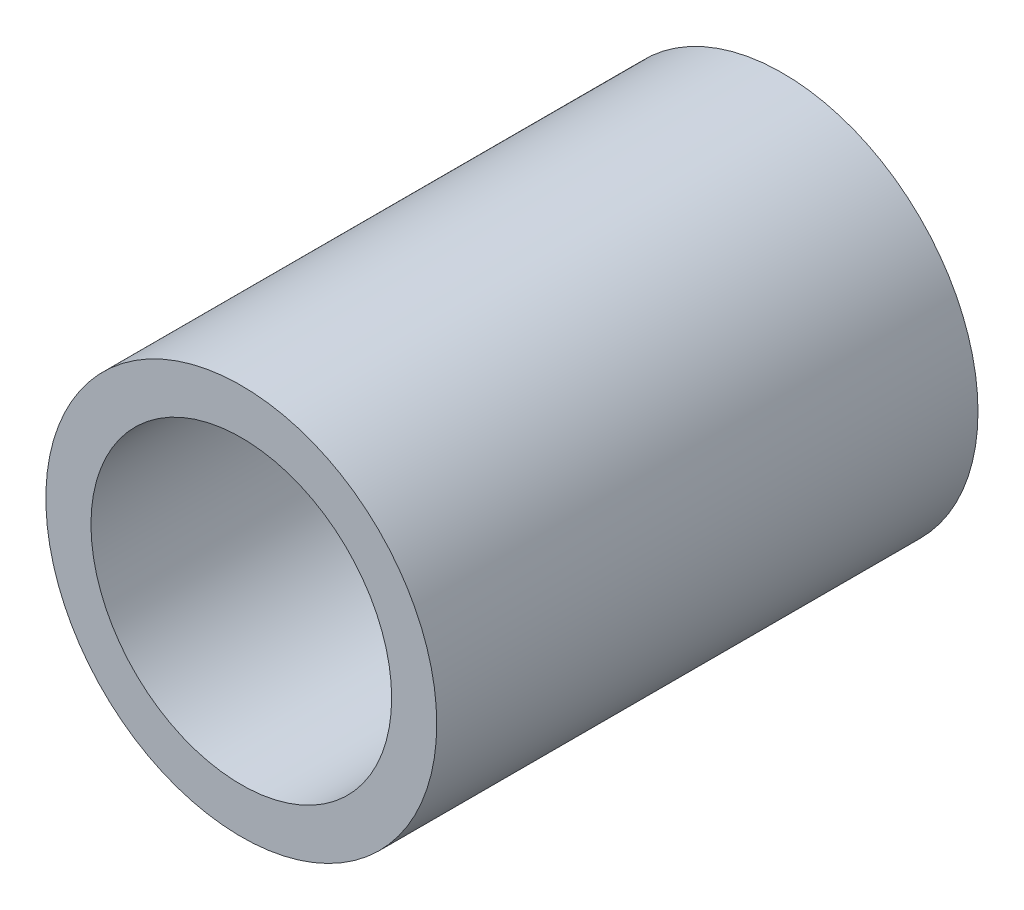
SolidWorks part; units mm, degrees
ref_plane "Plan de face" through (0, 0, 0) normal (0, 0, 1) x (1, 0, 0)
ref_plane "Plan de dessus" through (0, 0, 0) normal (0, 1, 0) x (1, 0, 0)
ref_plane "Plan de droite" through (0, 0, 0) normal (1, 0, 0) x (0, 0, -1)
sketch "Esquisse1" plane through (0, 0, 0) normal (0, 0, 1) x (1, 0, 0)
  circle A0 centre (0, 0) radius 3.25
  circle A1 centre (0, 0) radius 2.5
  dimension "D1" = 5
  dimension "D2" = 6.5
extrude "Extrusion1" add sketch "Esquisse1" along normal blind 9
